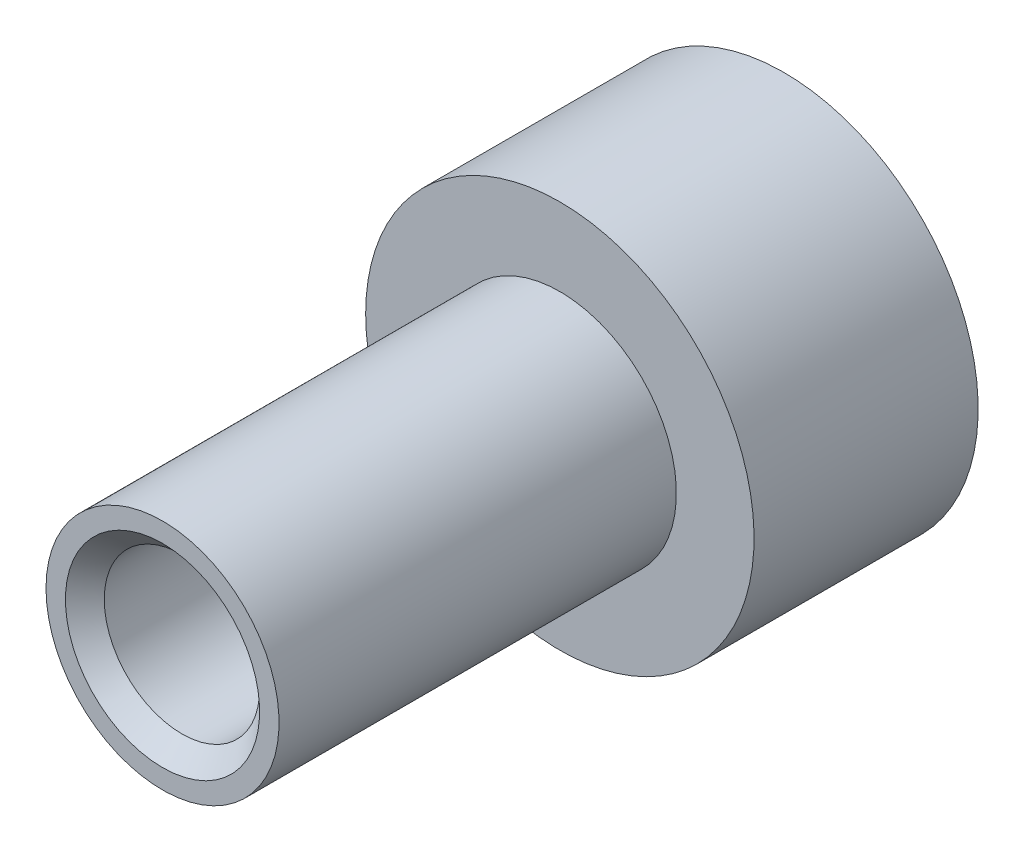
SolidWorks part; units mm, degrees
ref_plane "Front Plane" through (0, 0, 0) normal (0, 0, 1) x (1, 0, 0)
ref_plane "Top Plane" through (0, 0, 0) normal (0, 1, 0) x (1, 0, 0)
ref_plane "Right Plane" through (0, 0, 0) normal (1, 0, 0) x (0, 0, -1)
sketch "Sketch2" plane through (0, 0, -7.8722) normal (0, 0, 1) x (1, 0, 0)
  circle A1 centre (-40.7291, -59.295) radius 2
  circle A2 centre (-40.7291, -59.295) radius 3
  dimension "D1" = 1
extrude "Boss-Extrude1" add sketch "Sketch2" along normal up to surface (16 mm away) contours A1 | A2
sketch "Sketch3" plane through (0, 0, -7.8722) normal (0, 0, -1) x (-1, 0, 0)
  circle A0 centre (40.7291, -59.295) radius 3 construction
  circle A1 centre (40.7291, -59.295) radius 3
  circle A4 centre (40.7291, -59.295) radius 5
  circle A5 centre (40.7291, -59.295) radius 5
  dimension "D1" = 2
extrude "Boss-Extrude2" add sketch "Sketch3" against normal up to surface (5.77 mm away) contours A5 | A1
chamfer "Chamfer1" distance 0.5 angle 45 2 edges at (-38.7291, -59.295, -7.8722) (-40.7291, -61.295, 8.1278)
